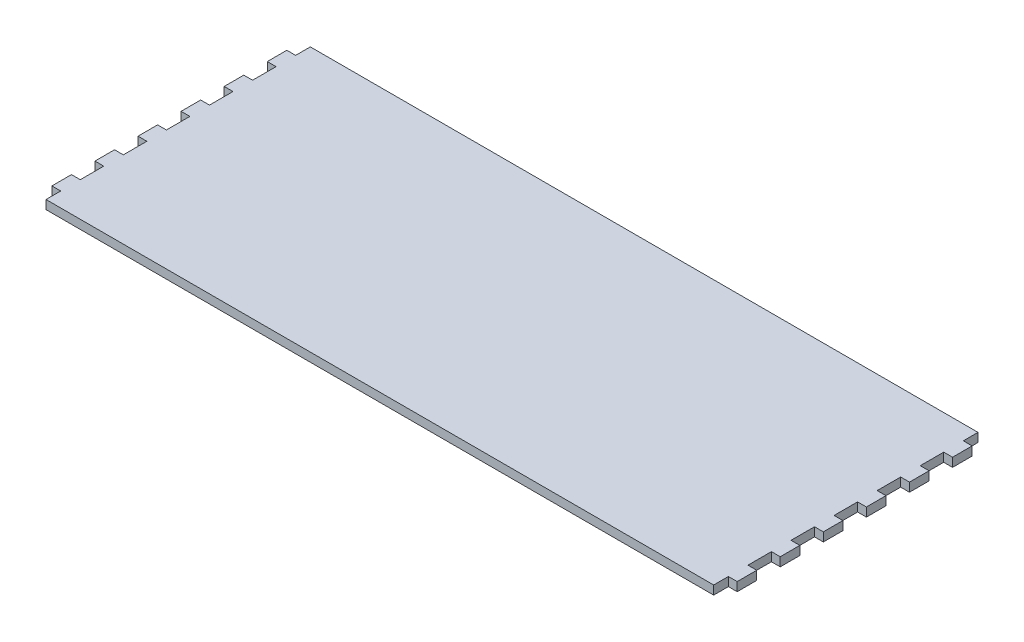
SolidWorks part; units mm, degrees
ref_plane "Front Plane" through (0, 0, 0) normal (0, 0, 1) x (1, 0, 0)
ref_plane "Top Plane" through (0, 0, 0) normal (0, 1, 0) x (1, 0, 0)
ref_plane "Right Plane" through (0, 0, 0) normal (1, 0, 0) x (0, 0, -1)
sketch "Sketch1" plane through (0, 0, 0) normal (0, 1, 0) x (1, 0, 0)
  line L1 (-341, 135) -> (341, 135)
  line L2 (-341, 135) -> (-341, -135)
  line L3 (-341, -135) -> (341, -135)
  line L4 (341, 135) -> (341, -135)
  line L5 (-341, 135) -> (341, -135) construction
  line L6 (-341, -135) -> (341, 135) construction
  point P0 (0, 0)
  dimension "D1" = 682
  dimension "D2" = 270
extrude "Boss-Extrude1" add sketch "Sketch1" along normal blind 9
sketch "Sketch3" plane through (0, 9, 0) normal (0, 1, 0) x (1, 0, 0)
  line L0 (-341, 135) -> (-341, -135) construction
  line L1 (-341, -120) -> (-350, -120)
  line L2 (-341, -120) -> (-341, -100)
  line L3 (-341, -100) -> (-350, -100)
  line L4 (-350, -120) -> (-350, -100)
  line L5 (-341, -135) -> (341, -135) construction
  line L6 (-341, -76) -> (-341, -56)
  line L7 (-341, -76) -> (-350, -76)
  line L8 (-350, -76) -> (-350, -56)
  line L9 (-341, -56) -> (-350, -56)
  line L10 (-341, -32) -> (-341, -12)
  line L11 (-341, -32) -> (-350, -32)
  line L12 (-350, -32) -> (-350, -12)
  line L13 (-341, -12) -> (-350, -12)
  line L14 (-341, 12) -> (-341, 32)
  line L15 (-341, 12) -> (-350, 12)
  line L16 (-350, 12) -> (-350, 32)
  line L17 (-341, 32) -> (-350, 32)
  line L18 (-341, 56) -> (-341, 76)
  line L19 (-341, 56) -> (-350, 56)
  line L20 (-350, 56) -> (-350, 76)
  line L21 (-341, 76) -> (-350, 76)
  line L22 (-341, 100) -> (-341, 120)
  line L23 (-341, 100) -> (-350, 100)
  line L24 (-350, 100) -> (-350, 120)
  line L25 (-341, 120) -> (-350, 120)
  line L26 (0, 223.5542) -> (0, -188.523) construction
  line L27 (341, -100) -> (350, -100)
  line L28 (350, -120) -> (350, -100)
  line L29 (341, -120) -> (350, -120)
  line L30 (341, -120) -> (341, -100)
  line L31 (341, -76) -> (350, -76)
  line L32 (350, -76) -> (350, -56)
  line L33 (341, -56) -> (350, -56)
  line L34 (341, -76) -> (341, -56)
  line L35 (341, -32) -> (350, -32)
  line L36 (350, -32) -> (350, -12)
  line L37 (341, -12) -> (350, -12)
  line L38 (341, -32) -> (341, -12)
  line L39 (341, 12) -> (350, 12)
  line L40 (350, 12) -> (350, 32)
  line L41 (341, 32) -> (350, 32)
  line L42 (341, 12) -> (341, 32)
  line L43 (341, 56) -> (350, 56)
  line L44 (350, 56) -> (350, 76)
  line L45 (341, 76) -> (350, 76)
  line L46 (341, 56) -> (341, 76)
  line L47 (341, 100) -> (350, 100)
  line L48 (350, 100) -> (350, 120)
  line L49 (341, 120) -> (350, 120)
  line L50 (341, 100) -> (341, 120)
  dimension "D1" = 9
  dimension "D2" = 20
  dimension "D3" = 15
  dimension "D4" = 6
extrude "Boss-Extrude2" add sketch "Sketch3" against normal up to surface (9 mm away)
